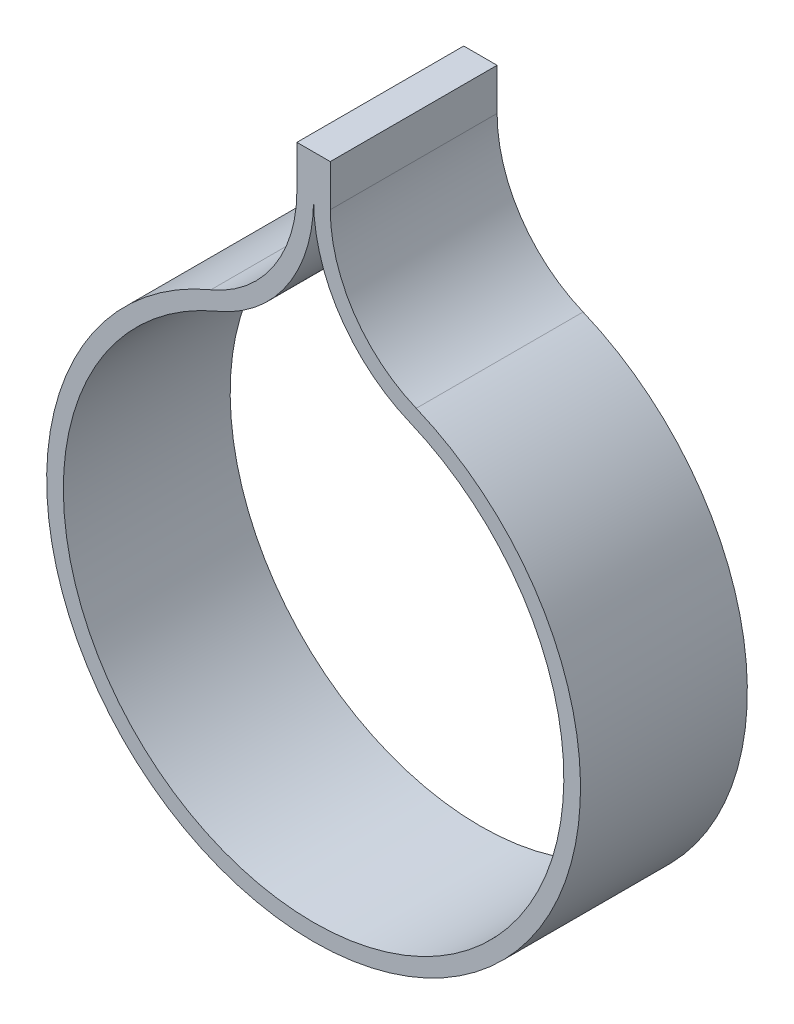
SolidWorks part; units mm, degrees
ref_plane "Front Plane" through (0, 0, 0) normal (0, 0, 1) x (1, 0, 0)
ref_plane "Top Plane" through (0, 0, 0) normal (0, 1, 0) x (1, 0, 0)
ref_plane "Right Plane" through (0, 0, 0) normal (1, 0, 0) x (0, 0, -1)
sketch "Sketch1" plane through (0, 0, 0) normal (0, 0, 1) x (1, 0, 0)
  line L0 (0, 57.15) -> (0, 0) construction
  line L3 (-2.54, 57.15) -> (-2.54, 63.5)
  line L4 (-2.54, 63.5) -> (2.54, 63.5)
  line L5 (2.54, 57.15) -> (2.54, 63.5)
  arc A0 (-14.6538, 35.1692) -> (14.6538, 35.1692) centre (0, 0) ccw
  arc A1 (-15.6308, 37.5138) -> (15.6308, 37.5138) centre (0, 0) ccw
  arc A2 (-14.6538, 35.1692) -> (0, 57.15) centre (-23.8125, 57.15) ccw
  arc A3 (0, 57.15) -> (14.6538, 35.1692) centre (23.8125, 57.15) ccw
  arc A4 (-15.6308, 37.5138) -> (-2.54, 57.15) centre (-23.8125, 57.15) ccw
  arc A5 (2.54, 57.15) -> (15.6308, 37.5138) centre (23.8125, 57.15) ccw
  dimension "D1" = 2.54
  dimension "D2" = 76.2
  dimension "D3" = 2.54
  dimension "D4" = 57.15
  dimension "D5" = 6.35
extrude "Boss-Extrude1" add sketch "Sketch1" along normal blind 25.4
